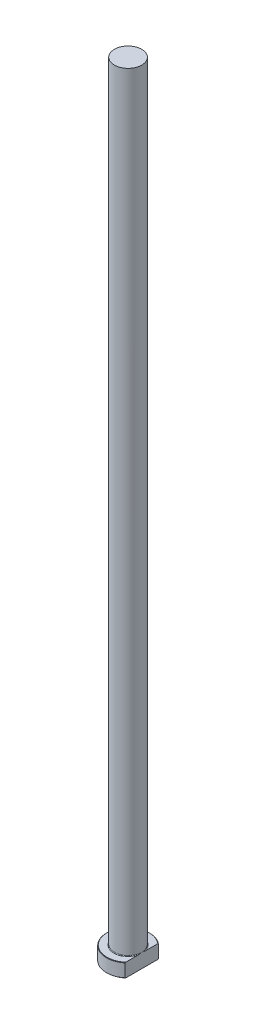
SolidWorks part; units mm, degrees
ref_plane "Front Plane" through (0, 0, 0) normal (0, 0, 1) x (1, 0, 0)
ref_plane "Top Plane" through (0, 0, 0) normal (0, 1, 0) x (1, 0, 0)
ref_plane "Right Plane" through (0, 0, 0) normal (1, 0, 0) x (0, 0, -1)
sketch "Sketch1" plane through (0, 0, 0) normal (0, 0, 1) x (1, 0, 0)
  line L0 (0, 259.9588) -> (0, -15.1925) construction
  line L1 (0, 0) -> (-11, 0)
  line L2 (-11, 0) -> (-11, 7)
  line L3 (-11, 7) -> (-7, 7)
  line L4 (-7, 7) -> (-7, 400)
  line L5 (-7, 400) -> (0, 400)
  line L6 (0, 400) -> (0, 0)
  dimension "L" = 400
  dimension "H" = 22
  dimension "T" = 7
  dimension "D" = 14
revolve "Revolve1" add sketch "Sketch1" angle 360 about L0
chamfer "Chamfer1" distance 0.2 angle 45 2 edges at (0, 7, 11) (0, 0, 11)
fillet "Fillet1" radius 0.3 1 edges at (0, 7, 7)
sketch "Sketch2" plane through (0, 0, 0) normal (0, 1, 0) x (1, 0, 0)
  line L0 (7, 8.4853) -> (7, -8.4853)
  circle A0 centre (0, 0) radius 11 construction
  arc A1 (7, -8.4853) -> (7, 8.4853) centre (0, 0) ccw
  circle A2 centre (0, 0) radius 7 construction
extrude "KEY" cut sketch "Sketch2" along normal through all
